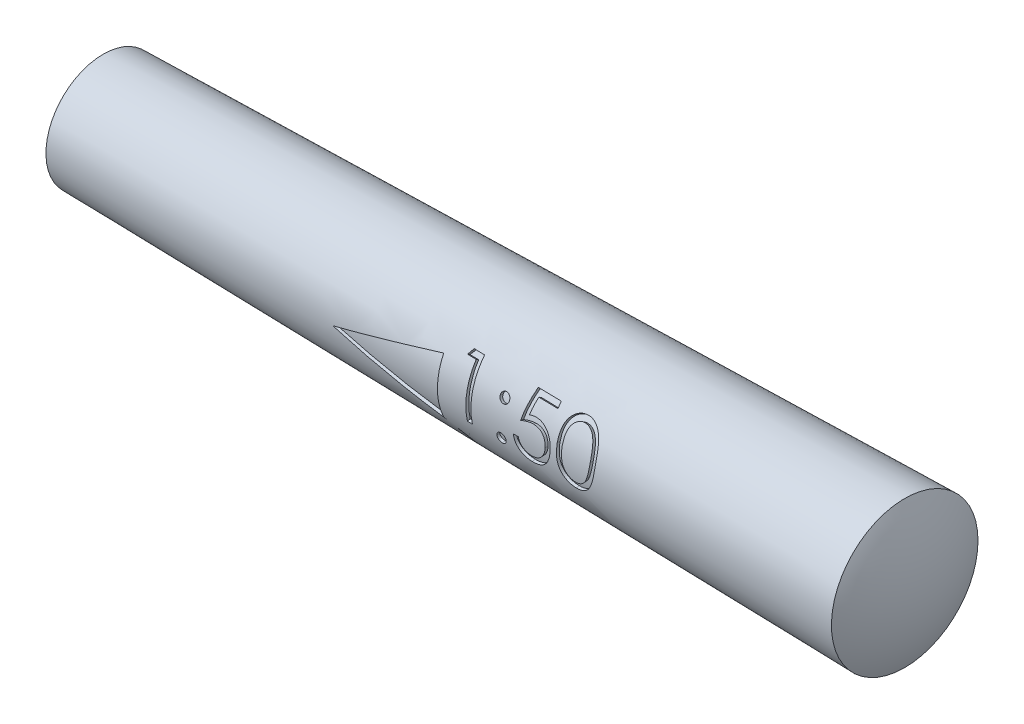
SolidWorks part; units mm, degrees
ref_plane "Front Plane" through (0, 0, 0) normal (0, 0, 1) x (1, 0, 0)
ref_plane "Top Plane" through (0, 0, 0) normal (0, 1, 0) x (1, 0, 0)
ref_plane "Right Plane" through (0, 0, 0) normal (1, 0, 0) x (0, 0, -1)
sketch "Sketch1" plane through (0, 0, 0) normal (1, 0, 0) x (0, 0, -1)
  circle A0 centre (0, 0) radius 1
  dimension "D1" = 2
extrude "Extrude1" add sketch "Sketch1" along normal mid plane 14
draft "Draft1" type of draft neutral plane draft angle 1.146 faces to draft 1 parameters "D1"=1.146
sketch "Sketch2" plane through (0, 0, 0) normal (0, 0, 1) x (1, 0, 0)
  line L0 (-7, 0) -> (-7, 1)
  line L1 (-7, 1) -> (-7, -1) construction
  line L2 (-7, 0) -> (-7.3, 0)
  line L3 (-7.3, 0) -> (-7.3, -1.14) construction
  line L4 (7, 0) -> (7, 1.28)
  line L5 (7, -1.28) -> (7, 1.28) construction
  line L6 (7, 0) -> (7.3, 0)
  line L7 (7.3, 0) -> (7.3, -1.14) construction
  line L8 (-7, -1) -> (7, -1.28) construction
  arc A0 (-7.3, 0) -> (-7, 1) centre (-5.4833, 0) cw
  arc A1 (7.3, 0) -> (7, 1.28) centre (4.4193, 0) ccw
  point P14 (0, -1.14)
revolve "Revolve1" add sketch "Sketch2" angle 360 about L2
sketch "Sketch5" plane through (0, 0, 0) normal (0, 0, 1) x (1, 0, 0)
  line L0 (0, 1.14) -> (0, -1.14) construction
  line L1 (7, 1.28) -> (-7, 1) construction
  line L2 (-7, -1) -> (7, -1.28) construction
ref_plane "Plane2" through (0, 0, 0) normal (-0.02, 0, 0.9998) x (0.9998, 0, 0.02)
sketch "Sketch6" plane through (0, 0, 0) normal (-0.02, 0, 0.9998) x (0.9998, 0, 0.02)
  line L0 (0, 0) -> (0, 0.5)
  line L1 (0, 1.14) -> (0, -1.14) construction
  line L2 (0, 0.5) -> (-1.866, 0)
  line L3 (-1.866, 0) -> (0, -0.5)
  line L4 (0, -0.5) -> (0, 0)
  line L5 (0, -0.25) -> (3, -0.25) construction
  text T0 "1:50" font "Century Gothic" height 1
  dimension "D1" = 1
  dimension "D2" = 30
  dimension "D3" = 3
wrap "Wrap2" sketch "Sketch6" wrap type deboss source sketch "Sketch6" thickness 0.05 parameters "D1"=0.05
equation "\"D2@Sketch2\" = \"D1@Sketch2\""
